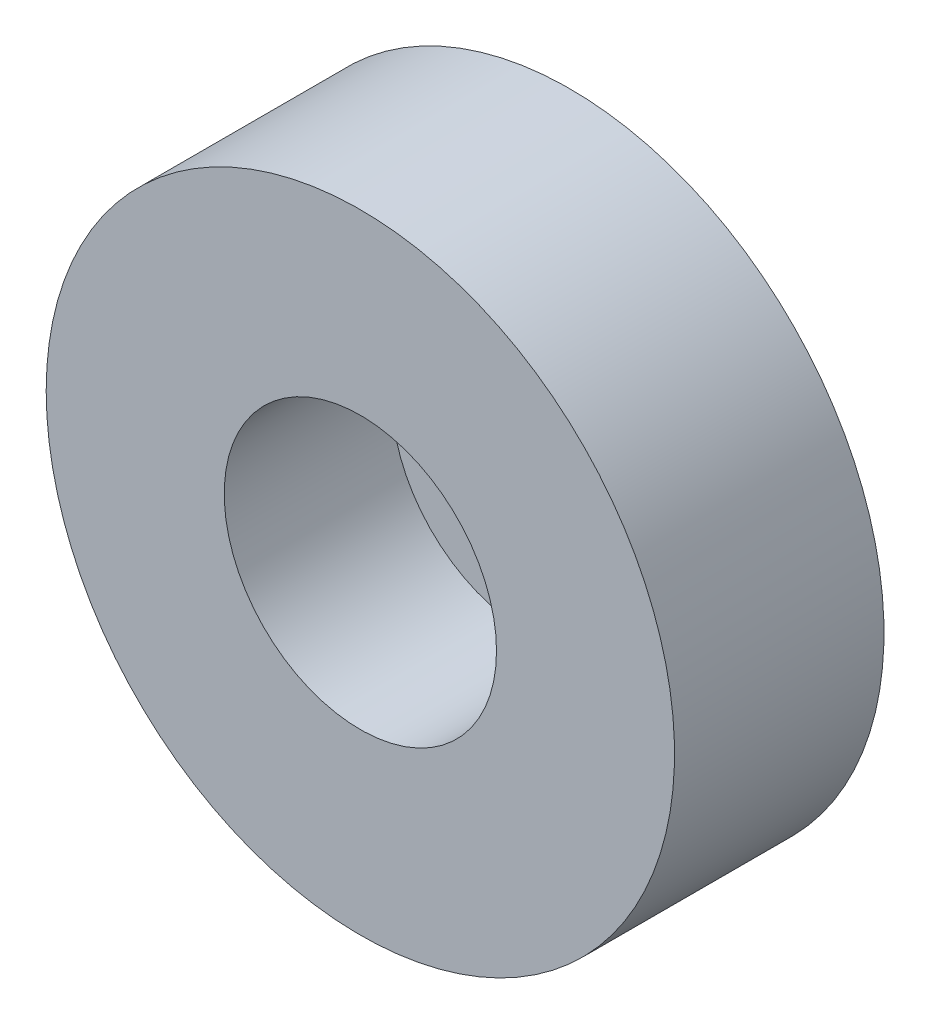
SolidWorks part; units mm, degrees
ref_plane "Face" through (0, 0, 0) normal (0, 0, 1) x (1, 0, 0)
ref_plane "Dessus" through (0, 0, 0) normal (0, 1, 0) x (1, 0, 0)
ref_plane "Droite" through (0, 0, 0) normal (1, 0, 0) x (0, 0, -1)
sketch "Esquisse1" plane through (0, 0, 0) normal (0, 0, 1) x (1, 0, 0)
  circle A0 centre (0, 0) radius 7.5
  circle A1 centre (0, 0) radius 1.5
  dimension "D1" = 3
  dimension "D2" = 15
extrude "Extrusion1" add sketch "Esquisse1" along normal blind 5
sketch "Esquisse2" plane through (0, 0, 5) normal (0, 0, 1) x (1, 0, 0)
  circle A0 centre (0, 0) radius 3.25
  dimension "D1" = 6.5
extrude "Enlèv. mat.-Extru.1" cut sketch "Esquisse2" against normal blind 4
